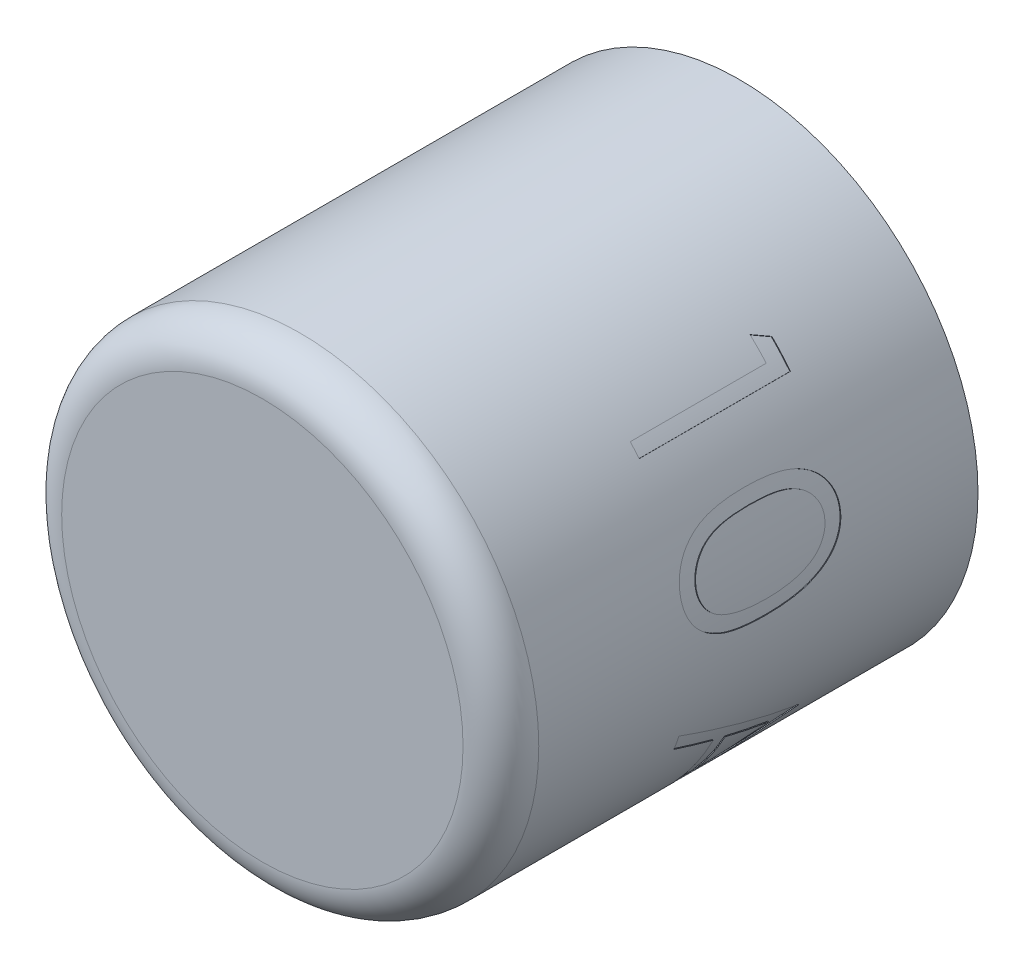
SolidWorks part; units mm, degrees
ref_plane "Front Plane" through (0, 0, 0) normal (0, 0, 1) x (1, 0, 0)
ref_plane "Top Plane" through (0, 0, 0) normal (0, 1, 0) x (1, 0, 0)
ref_plane "Right Plane" through (0, 0, 0) normal (1, 0, 0) x (0, 0, -1)
sketch "Sketch1" plane through (0, 0, 0) normal (0, 0, 1) x (1, 0, 0)
  circle A0 centre (0, 0) radius 3.15
  dimension "D1" = 6.3
ref_plane "Plane1" through (0, 0, 15.5) normal (0, 0, 1) x (1, 0, 0)
sketch "Sketch2" plane through (0, 0, 15.5) normal (0, 0, 1) x (1, 0, 0)
  circle A1 centre (0, 0) radius 3.15
  circle A2 centre (0, 0) radius 3.15
  dimension "D1" = 0
extrude "Boss-Extrude2" add sketch "Sketch2" against normal blind 6.3
fillet "Fillet2" radius 0.5 1 edges at (3.15, 0, 15.5)
shell "Shell2" thickness 0.25
sketch "Sketch3" [suppressed] plane through (0, 0, 0) normal (0, 0, 1) x (1, 0, 0)
  circle A0 centre (0, 0) radius 2.9
  circle A1 centre (0, 0) radius 3.15
  circle A2 centre (0, 0) radius 3.15 construction
  circle A3 centre (0, 0) radius 2.65
  dimension "D2" = 0.25
  dimension "D3" = 0.25
  dimension "D1" = 0
extrude "Boss-Extrude3" [suppressed] add sketch "Sketch3" along normal mid plane 30
sketch "Sketch4" [suppressed] plane through (0, 0, 0) normal (1, 0, 0) x (0, 0, -1)
  line L0 (-15.5, 4.95) -> (-15.5, -4.95) construction
  line L1 (15, -2.15) -> (7.5, -2.15)
  line L2 (15, -2.15) -> (15, 2.15)
  line L3 (15, 2.15) -> (7.5, 2.15)
  line L4 (-15, -2.15) -> (-15, 2.15)
  line L5 (15, -2.15) -> (-15, 2.15) construction
  line L6 (15, 2.15) -> (-15, -2.15) construction
  line L7 (0, 3.15) -> (0, -3.15) construction
  line L8 (0, 3.15) -> (0, 2.15) construction
  line L9 (-7.5, 2.15) -> (-6.85, 1.5)
  line L10 (-6.85, 1.5) -> (6.85, 1.5)
  line L11 (6.85, 1.5) -> (7.5, 2.15)
  line L12 (-7.5, -2.15) -> (-6.85, -1.5)
  line L13 (-6.85, -1.5) -> (6.85, -1.5)
  line L14 (6.85, -1.5) -> (7.5, -2.15)
  line L15 (0, 1.5) -> (0, -1.5) construction
  line L16 (0, -2.15) -> (0, -3.15) construction
  line L17 (0, -2.15) -> (0, -1.5) construction
  line L18 (0, 1.5) -> (0, 2.15) construction
  line L19 (-7.5, 2.15) -> (-7.5, -2.15) construction
  line L20 (7.5, 2.15) -> (7.5, -2.15) construction
  line L21 (-7.5, 2.15) -> (-15, 2.15)
  line L22 (-7.5, -2.15) -> (-15, -2.15)
  point P0 (0, 0)
  point P22 (0, -1.5)
  point P23 (0, 1.5)
  point P25 (0, 0)
  dimension "D1" = 0.5
  dimension "D2" = 1
  dimension "D3" = 3
  dimension "D4" = 45
  dimension "D5" = 15
extrude "Boss-Extrude4" [suppressed] add sketch "Sketch4" along normal mid plane 0.25
sketch "Sketch5" [suppressed] plane through (0, 0, 0) normal (0, 0, 1) x (1, 0, 0)
  line L0 (-4, 2.3712) -> (4, 2.3712) construction
  line L1 (0, 2.3712) -> (0, 0) construction
  line L2 (4, 2.3712) -> (0, 7.3712) construction
  line L3 (0, 7.3712) -> (-4, 2.3712) construction
  line L4 (0, 2.3712) -> (0, 7.3712) construction
  line L5 (-4, -3.9903) -> (4, -3.9903) construction
  line L6 (0, -3.9903) -> (0, 0) construction
  line L7 (0, -9.7949) -> (0, -3.9903) construction
  line L8 (-3.1772, -12.9575) -> (3.1772, -12.9575)
  line L9 (0, -12.9575) -> (0, -9.7949) construction
  line L11 (-3.6877, 2.7616) -> (-3.063, 3.5425) construction
  line L12 (3.063, 3.5425) -> (3.6877, 2.7616) construction
  line L13 (-3.063, 3.5425) -> (-3.4534, 3.8548)
  line L14 (-3.4534, 3.8548) -> (-4.0781, 3.074)
  line L15 (-4.0781, 3.074) -> (-3.6877, 2.7616)
  line L16 (3.063, 3.5425) -> (3.4534, 3.8548)
  line L17 (3.4534, 3.8548) -> (4.0781, 3.074)
  line L18 (4.0781, 3.074) -> (3.6877, 2.7616)
  line L19 (-4, -3.9903) -> (-4, -23.5398) construction
  line L20 (-3.1772, -13.9575) -> (3.1772, -13.9575)
  circle A0 centre (0, 0) radius 3.15 construction
  arc A1 (-2.7097, 1.6063) -> (-2.2301, -2.2247) centre (0, 0) ccw
  arc A3 (3.063, 3.5425) -> (2.7097, 1.6063) centre (4, 2.3712) ccw
  arc A4 (-2.7097, 1.6063) -> (-3.063, 3.5425) centre (-4, 2.3712) ccw
  arc A5 (-1.8606, -5.2837) -> (-2.2301, -2.2247) centre (-4, -3.9903) ccw
  arc A6 (2.2301, -2.2247) -> (1.8606, -5.2837) centre (4, -3.9903) ccw
  arc A10 (2.2301, -2.2247) -> (2.7097, 1.6063) centre (0, 0) ccw
  arc A24 (-1.8606, -5.2837) -> (-3.9759, -12.1119) centre (10.8322, -12.9575) ccw
  arc A25 (-3.1772, -12.9575) -> (-3.9759, -12.1119) centre (-3.1772, -12.1575) cw
  arc A26 (1.8606, -5.2837) -> (3.9759, -12.1119) centre (-10.8322, -12.9575) cw
  arc A27 (3.1772, -12.9575) -> (3.9759, -12.1119) centre (3.1772, -12.1575) ccw
  arc A28 (3.6877, 2.7616) -> (3.5699, 2.1162) centre (4, 2.3712) ccw
  arc A29 (2.9381, -2.9309) -> (3.5699, 2.1162) centre (0, 0) ccw
  arc A30 (2.9381, -2.9309) -> (2.7164, -4.7664) centre (4, -3.9903) ccw
  arc A31 (2.7164, -4.7664) -> (4.9742, -12.0549) centre (-10.8322, -12.9575) cw
  arc A32 (3.1772, -13.9575) -> (4.9742, -12.0549) centre (3.1772, -12.1575) ccw
  arc A33 (-3.1772, -13.9575) -> (-4.9742, -12.0549) centre (-3.1772, -12.1575) cw
  arc A34 (-2.7164, -4.7664) -> (-4.9742, -12.0549) centre (10.8322, -12.9575) ccw
  arc A35 (-2.7164, -4.7664) -> (-2.9381, -2.9309) centre (-4, -3.9903) ccw
  arc A36 (-3.5699, 2.1162) -> (-2.9381, -2.9309) centre (0, 0) ccw
  arc A37 (-3.5699, 2.1162) -> (-3.6877, 2.7616) centre (-4, 2.3712) ccw
  point P29 (-4, -12.9575)
  dimension "D1" = 3
  dimension "D4" = 0.8
  dimension "D7" = 5
  dimension "D8" = 0.8
  dimension "D2" = 8
  dimension "D3" = 5
  dimension "D5" = 16.5
  dimension "D6" = 8
  dimension "D10" = 0.5
  dimension "D9" = 1
extrude "Boss-Extrude6" [suppressed] add sketch "Sketch5" along normal mid plane 7.8
sketch "Sketch6" [suppressed] plane through (0, 0, 0) normal (0, 1, 0) x (1, 0, 0)
  circle A0 centre (0, 0) radius 1.5
  dimension "D1" = 3
extrude "Cut-Extrude1" [suppressed] cut sketch "Sketch6" against normal up to next
fillet "Fillet4" [suppressed] radius 0.5
sketch "Sketch7" [suppressed] plane through (0, 0, 0) normal (1, 0, 0) x (0, 0, -1)
  line L0 (1.5, 0) -> (-1.5, 0) construction
  line L1 (0, 0) -> (-1.5, 0) construction
  line L2 (-1.5, -1) -> (-1.5, 1)
  line L3 (0, 0) -> (0, -2) construction
  line L4 (0, 3.15) -> (0, -3.15) construction
  line L5 (-1.5, 1) -> (-2.5, 1)
  line L6 (0, 0) -> (0, 1) construction
  line L7 (0, 1) -> (0, 2) construction
  line L8 (0, -2) -> (0, 2)
  line L9 (0, 1) -> (-1.5, 1) construction
  line L10 (-1.5, -1) -> (-2.5, -1)
  arc A1 (0, 2) -> (-2.5, 1) centre (0, -1.625) ccw
  arc A2 (-2.5, -1) -> (0, -2) centre (0, 1.625) ccw
  point P5 (-1.5, 0)
  point P7 (1.5, 0)
  dimension "D1" = 1
  dimension "D2" = 2
  dimension "D3" = 2.5
revolve "Revolve1" [suppressed] add sketch "Sketch7" angle 360 about L8
sketch "Sketch8" [suppressed] plane through (0, 0, 0) normal (1, 0, 0) x (0, 0, -1)
  line L0 (0, 3.15) -> (0, -3.15) construction
  line L1 (0, 2.15) -> (0, 0.5) construction
  line L2 (-15.5, 3.465) -> (-15.5, -3.465) construction
  line L3 (-15, -2.15) -> (-8.65, -2.15)
  line L4 (-15, -2.15) -> (-15, 2.15)
  line L5 (-15, 2.15) -> (-8.65, 2.15)
  line L6 (15, -2.15) -> (15, 2.15)
  line L7 (-15, -2.15) -> (15, 2.15) construction
  line L8 (-15, 2.15) -> (15, -2.15) construction
  line L9 (-7, 0.5) -> (7, 0.5)
  line L10 (-7, -0.5) -> (7, -0.5)
  line L11 (0, -0.5) -> (0, -2.15) construction
  line L12 (-7, 0.5) -> (-8.65, 2.15)
  line L13 (-7, -0.5) -> (-8.65, -2.15)
  line L14 (-8.65, -2.15) -> (-8.65, 2.15) construction
  line L15 (7, -0.5) -> (8.65, -2.15)
  line L16 (8.65, -2.15) -> (8.65, 2.15) construction
  line L17 (8.65, 2.15) -> (7, 0.5)
  line L18 (8.65, -2.15) -> (15, -2.15)
  line L19 (8.65, 2.15) -> (15, 2.15)
  point P2 (0, 0)
  point P13 (0, 0.5)
  point P16 (0, -0.5)
  dimension "D1" = 0.5
  dimension "D2" = 4.3
  dimension "D3" = 1
  dimension "D4" = 14
  dimension "D5" = 45
extrude "Boss-Extrude7" [suppressed] add sketch "Sketch8" along normal mid plane 0.25
ref_plane "Plane2" through (0, 3.15, 0) normal (0, 1, 0) x (1, 0, 0)
ref_plane "Plane3" through (3.15, 0, 0) normal (1, 0, 0) x (0, 0, -1)
sketch "Sketch9" plane through (3.15, 0, 0) normal (-1, 0, 0) x (0, 1, 0)
  line L0 (-3.15, -13) -> (3.15, -13) construction
  line L1 (-3.15, -9.2) -> (-3.15, -15) construction
  line L2 (3.15, -15) -> (3.15, -9.2) construction
  line L3 (-3.465, -15.5) -> (3.465, -15.5) construction
  text T0 "15 A" font "Century Gothic" height 2
  dimension "D1" = 2.5
wrap "Wrap1" [suppressed] sketch "Sketch9" source sketch "Sketch9" thickness 0.01 parameters "D1"=0.01
sketch "Sketch11" plane through (3.15, 0, 0) normal (-1, 0, 0) x (0, 1, 0)
  line L0 (-3.15, -13) -> (3.15, -13) construction
  line L1 (-3.15, -9.2) -> (-3.15, -15) construction
  line L2 (3.15, -15) -> (3.15, -9.2) construction
  line L3 (-3.465, -15.5) -> (3.465, -15.5) construction
  text T0 "10 A" font "Century Gothic" height 2
  dimension "D1" = 2.5
wrap "Wrap2" sketch "Sketch11" wrap type deboss source sketch "Sketch11" thickness 0.01 parameters "D1"=0.01
